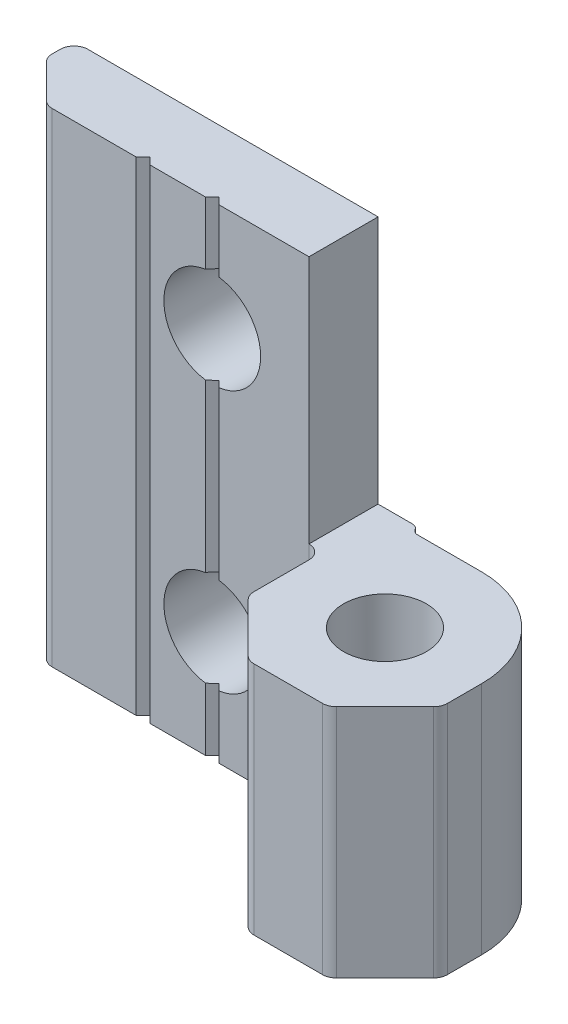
SolidWorks part; units mm, degrees
ref_plane "正面" through (0, 0, 0) normal (0, 0, 1) x (1, 0, 0)
ref_plane "平面" through (0, 0, 0) normal (0, 1, 0) x (1, 0, 0)
ref_plane "右側面" through (0, 0, 0) normal (1, 0, 0) x (0, 0, -1)
sketch "ｽｹｯﾁ1" plane through (0, 0, 0) normal (0, 1, 0) x (1, 0, 0)
  line L0 (-30, 5.9142) -> (-30, 6.5)
  line L1 (-29.7071, 5.2071) -> (-27.2929, 2.7929)
  line L2 (-19.5, 2.5) -> (-15.5, 2.5)
  line L3 (-15, 3) -> (-15.5, 2.5)
  line L4 (-15, 3) -> (-14.5, 2.5)
  line L5 (-20, 3) -> (-19.5, 2.5)
  line L6 (-20, 3) -> (-20.5, 2.5)
  line L7 (-7, -2.4853) -> (-7, 1.5)
  line L8 (-14.5, 2.5) -> (-8, 2.5)
  line L9 (0, 7) -> (-4.634, 7)
  line L10 (7, 0) -> (7, -2.4853)
  line L11 (2.4853, -7) -> (-2.4853, -7)
  line L12 (6.7071, -3.1924) -> (3.1924, -6.7071)
  line L13 (-3.1924, -6.7071) -> (-6.7071, -3.1924)
  line L14 (-29, 7.5) -> (-5.5, 7.5)
  line L15 (-26.5858, 2.5) -> (-20.5, 2.5)
  arc A0 (-27.2929, 2.7929) -> (-26.5858, 2.5) centre (-26.5858, 3.5) ccw
  arc A1 (-29, 7.5) -> (-30, 6.5) centre (-29, 6.5) ccw
  arc A2 (-30, 5.9142) -> (-29.7071, 5.2071) centre (-29, 5.9142) ccw
  arc A3 (-7, 1.5) -> (-8, 2.5) centre (-8, 1.5) ccw
  arc A4 (-7, -2.4853) -> (-6.7071, -3.1924) centre (-6, -2.4853) ccw
  arc A5 (-5.067, 7.25) -> (-4.634, 7) centre (-4.634, 7.5) ccw
  arc A6 (7, 0) -> (0, 7) centre (0, 0) ccw
  arc A7 (-3.1924, -6.7071) -> (-2.4853, -7) centre (-2.4853, -6) ccw
  arc A8 (2.4853, -7) -> (3.1924, -6.7071) centre (2.4853, -6) ccw
  circle A9 centre (0, 0) radius 3
  arc A10 (6.7071, -3.1924) -> (7, -2.4853) centre (6, -2.4853) ccw
  arc A11 (-5.067, 7.25) -> (-5.5, 7.5) centre (-5.5, 7) ccw
extrude "ﾎﾞｽ - 押し出し1" add sketch "ｽｹｯﾁ1" along normal blind 35
sketch "ｽｹｯﾁ2" plane through (0, 0, -7.5) normal (0, 0, -1) x (-1, 0, 0)
  line L1 (-17.8242, 41.9151) -> (8, 41.9151)
  line L2 (-17.8242, 41.9151) -> (-17.8242, 17)
  line L3 (-17.8242, 17) -> (8, 17)
  line L4 (8, 41.9151) -> (8, 17)
  line L5 (-7, 35) -> (-7, 0) construction
  line L6 (14.5, 35) -> (8, 35) construction
  dimension "D1" = 18
  dimension "D2" = 15
extrude "ｶｯﾄ - 押し出し1" cut sketch "ｽｹｯﾁ2" against normal blind 35
hole_wizard "Ø7.0 (7) 直径の穴1" positions "3Dｽｹｯﾁ1" profile "ｽｹｯﾁ3" hole size "Ø7.0" standard "Jis"
sketch3d "3Dｽｹｯﾁ1"
  line L0 (-26.5858, 35, -2.5) -> (-20.5, 35, -2.5) construction
  line L1 (-8, 35, -2.5) -> (-8, 17, -2.5) construction
  point P0 (-15, 27, -2.5)
  point P2 (-15, 8, -2.5)
  dimension "D1" = 8
  dimension "D2" = 19
  dimension "D3" = 7
sketch "ｽｹｯﾁ3" plane through (-15, 27, -2.5) normal (1, 0, 0) x (0, -1, 0)
  line L0 (0, 0) -> (0, 32.103)
  line L1 (0, 32.103) -> (3.5, 30)
  line L2 (3.5, 30) -> (3.5, 0)
  line L5 (3.5, 0) -> (0, 0)
  line L10 (0, 32.103) -> (-3.5, 30) construction
  line L11 (0, -6.35) -> (0, 107.95) construction
  dimension "穴の直径" = 7
  dimension "穴の深さ" = 30
  dimension "ﾄﾞﾘﾙ角度" = 118
